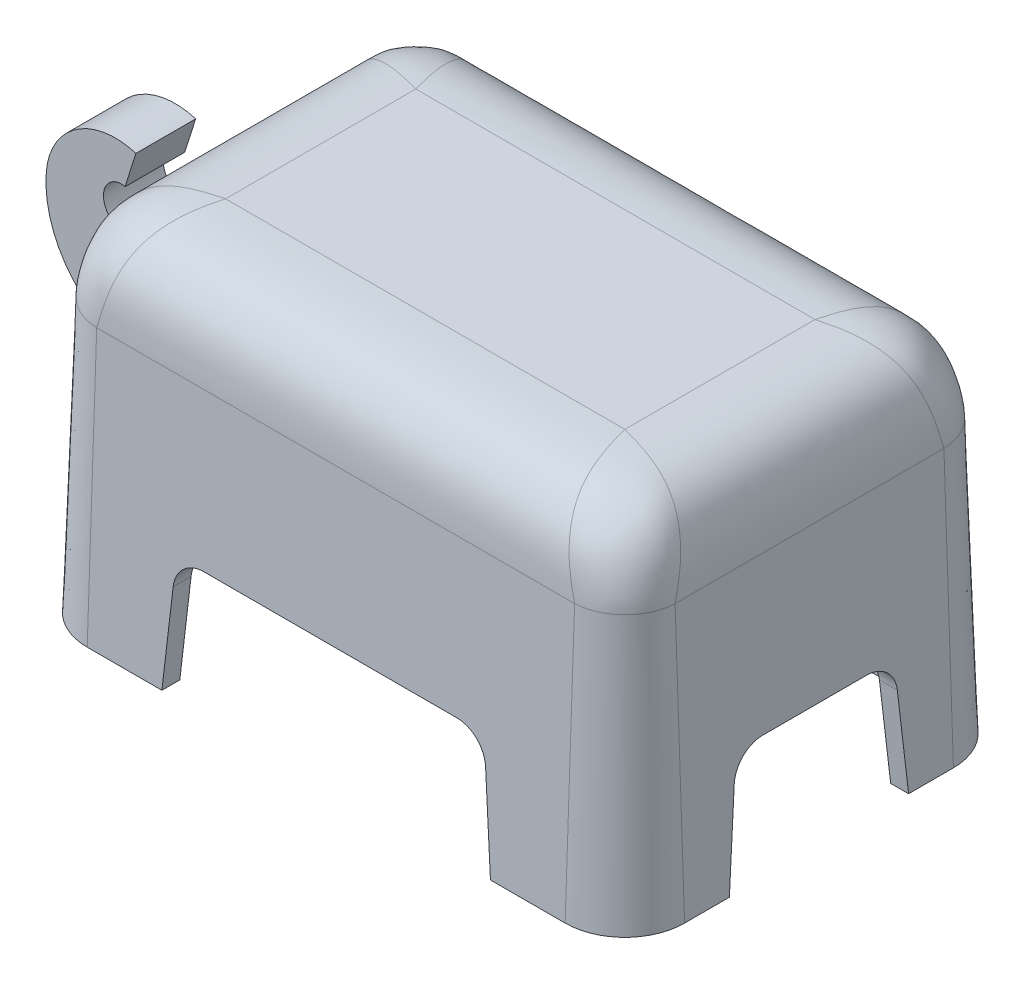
SolidWorks part; units mm, degrees
ref_plane "Front Plane" through (0, 0, 0) normal (0, 0, 1) x (1, 0, 0)
ref_plane "Top Plane" through (0, 0, 0) normal (0, 1, 0) x (1, 0, 0)
ref_plane "Right Plane" through (0, 0, 0) normal (1, 0, 0) x (0, 0, -1)
sketch "Sketch1" plane through (0, 0, 0) normal (0, 1, 0) x (1, 0, 0)
  line L1 (-40, -32.5) -> (40, -32.5)
  line L2 (-50, -22.5) -> (-50, 22.5)
  line L3 (-40, 32.5) -> (40, 32.5)
  line L4 (50, -22.5) -> (50, 22.5)
  line L5 (-50, -32.5) -> (50, 32.5) construction
  line L6 (-50, 32.5) -> (50, -32.5) construction
  arc A0 (-40, -32.5) -> (-50, -22.5) centre (-40, -22.5) cw
  arc A1 (40, -32.5) -> (50, -22.5) centre (40, -22.5) ccw
  arc A2 (40, 32.5) -> (50, 22.5) centre (40, 22.5) cw
  arc A3 (-50, 22.5) -> (-40, 32.5) centre (-40, 22.5) cw
  point P0 (0, 0)
  dimension "D3" = 10
  dimension "D1" = 100
  dimension "D2" = 65
extrude "Boss-Extrude1" add sketch "Sketch1" along normal blind 60 draft 2
fillet "Fillet1" radius 15 4 edges at (-47.9048, 60, 0) (0, 60, -30.4048) (47.9048, 60, 0) (0, 60, 30.4048)
shell "Shell1" thickness 3
sketch "Sketch2" plane through (0, 0, 0) normal (0, 0, 1) x (1, 0, 0)
  line L0 (27.5, 0) -> (-27.5, 0)
  line L1 (-40, 0) -> (40, 0) construction
  line L2 (-27.5, 0) -> (-26.1495, 15.4358)
  line L3 (-21.1686, 20) -> (21.1686, 20)
  line L4 (26.1495, 15.4358) -> (27.5, 0)
  line L5 (-27.5, 0) -> (27.5, 0)
  arc A0 (21.1686, 20) -> (26.1495, 15.4358) centre (21.1686, 15) cw
  arc A1 (-26.1495, 15.4358) -> (-21.1686, 20) centre (-21.1686, 15) cw
  dimension "D4" = 5
  dimension "D1" = 55
  dimension "D2" = 85
  dimension "D3" = 20
extrude "Cut-Extrude1" cut sketch "Sketch2" against normal mid plane 70 contours A1 L2 L0 L4 A0 L3
sketch "Sketch3" plane through (0, 0, 0) normal (1, 0, 0) x (0, 0, -1)
  line L0 (-15, 0) -> (-13.6495, 15.4358)
  line L1 (-22.5, 0) -> (22.5, 0) construction
  line L2 (-8.6686, 20) -> (8.6686, 20)
  line L4 (15, 0) -> (-15, 0)
  line L5 (13.6495, 15.4358) -> (15, 0)
  arc A0 (8.6686, 20) -> (13.6495, 15.4358) centre (8.6686, 15) cw
  arc A1 (-13.6495, 15.4358) -> (-8.6686, 20) centre (-8.6686, 15) cw
  dimension "D4" = 5
  dimension "D1" = 30
  dimension "D2" = 20
  dimension "D3" = 85
extrude "Cut-Extrude2" cut sketch "Sketch3" against normal through all both and the other way through all
sketch "Sketch4" plane through (0, 0, 0) normal (0, 0, 1) x (1, 0, 0)
  line L0 (-48.673, 38) -> (-49.3016, 20)
  line L1 (-48.4103, 45.5235) -> (-50, 0) construction
  line L2 (-48.673, 38) -> (-74.3482, 38) construction
  line L3 (-59.3438, 48.1692) -> (-61.1754, 42.4114)
  line L4 (-61.1754, 42.4114) -> (-64.1217, 43.3486) construction
  line L5 (-64.1217, 43.3486) -> (-69.8964, 38.7411) construction
  line L6 (-69.8964, 38.7411) -> (-62.6826, 27.9846) construction
  line L7 (-62.6826, 27.9846) -> (-49.7631, 35.8439) construction
  line L8 (-49.7631, 35.8439) -> (-48.673, 38) construction
  arc A0 (-49.3016, 20) -> (-74.3482, 38) centre (-56.4077, 36.5379) cw
  arc A1 (-74.3482, 38) -> (-59.3438, 48.1692) centre (-62.7598, 37.0556) cw
  spline_without_curve S0
  dimension "D1" = 18
  dimension "D3" = 18
  dimension "D2" = 20
extrude "Boss-Extrude2" add sketch "Sketch4" along normal mid plane 10
